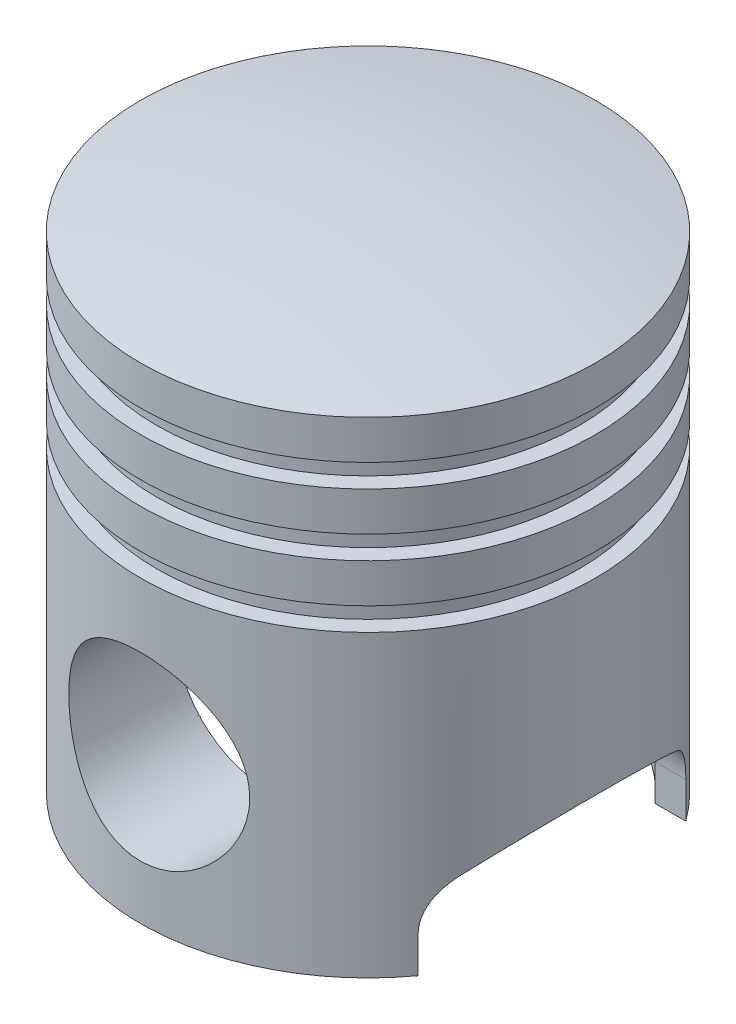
SolidWorks part; units mm, degrees
ref_plane "Ön Düzlem" through (0, 0, 0) normal (0, 0, 1) x (1, 0, 0)
ref_plane "Üst Düzlem" through (0, 0, 0) normal (0, 1, 0) x (1, 0, 0)
ref_plane "Sağ Düzlem" through (0, 0, 0) normal (1, 0, 0) x (0, 0, -1)
sketch "Sketch1" plane through (0, 0, 0) normal (0, 0, 1) x (1, 0, 0)
  line L0 (0, 0) -> (42.5, 0) construction
  line L1 (0, 0) -> (0, 90) construction
  line L2 (42.5, 90.7) -> (42.5, 83.4)
  line L3 (42.5, 83.4) -> (39.5, 83.4)
  line L4 (39.5, 83.4) -> (39.5, 79.1)
  line L5 (39.5, 79.1) -> (42.5, 79.1)
  line L6 (42.5, 79.1) -> (42.5, 71.8)
  line L7 (42.5, 71.8) -> (39.5, 71.8)
  line L8 (39.5, 71.8) -> (39.5, 67.5)
  line L9 (39.5, 67.5) -> (42.5, 67.5)
  line L10 (42.5, 67.5) -> (42.5, 60.2)
  line L11 (42.5, 60.2) -> (39.5, 60.2)
  line L12 (39.5, 60.2) -> (39.5, 55.9)
  line L13 (39.5, 55.9) -> (42.5, 55.9)
  line L14 (42.5, 55.9) -> (42.5, 0)
  line L15 (0, 90) -> (0, 95) construction
  line L16 (0, 95) -> (42.5, 95) construction
  line L17 (0, 85) -> (38, 85)
  line L18 (38, 85) -> (38, 0)
  line L19 (38, 0) -> (42.5, 0)
  line L20 (0, 85) -> (0, 95)
  arc A0 (42.5, 90.7) -> (0, 95) centre (0, -117.1791) ccw
  dimension "D4" = 11.6
  dimension "D1" = 42.5
  dimension "D2" = 90
  dimension "D3" = 5
  dimension "D5" = 39.5
  dimension "D6" = 7.3
  dimension "D7" = 7.3
  dimension "D8" = 4.3
  dimension "D9" = 38
  dimension "D10" = 85
revolve "Revolve2" add sketch "Sketch1" angle 360 about L20
sketch "Sketch2" plane through (0, 0, 0) normal (0, 0, 1) x (1, 0, 0)
  circle A0 centre (0, 27) radius 16.9
  dimension "D1" = 33.8
  dimension "D2" = 27
extrude "Cut-Extrude1" cut sketch "Sketch2" against normal through all both and the other way through all
sketch "Sketch4" plane through (0, 0, 0) normal (1, 0, 0) x (0, 0, -1)
  line L0 (25, 12) -> (25, 0)
  line L1 (-42.5, 0) -> (42.5, 0) construction
  line L2 (-25, 12) -> (-25, 0)
  line L3 (-25, 0) -> (25, 0)
  arc A0 (-25, 12) -> (25, 12) centre (0, -19.225) cw
  point P3 (0, 20.775)
  dimension "D1" = 40
  dimension "D2" = 12
  dimension "D3" = 50
extrude "Cut-Extrude2" cut sketch "Sketch4" against normal through all both and the other way through all
fillet "Fillet1" radius 10 4 edges at (31.4937, 12, -25) (-31.4937, 12, -25) (-31.4937, 12, 25) (31.4937, 12, 25)
sketch "Sketch3" plane through (0, 0, 0) normal (0, 0, 1) x (1, 0, 0)
  circle A0 centre (0, 27) radius 22.5
  circle A1 centre (0, 27) radius 16.9 construction
  circle A2 centre (0, 27) radius 16.9
  dimension "D1" = 45
extrude "Boss-Extrude1" add sketch "Sketch3" along normal up to surface (11.6227 mm away) from offset 19
mirror "Mirror1" about plane through (0, 0, 0) normal (0, 0, 1) of "Boss-Extrude1"
